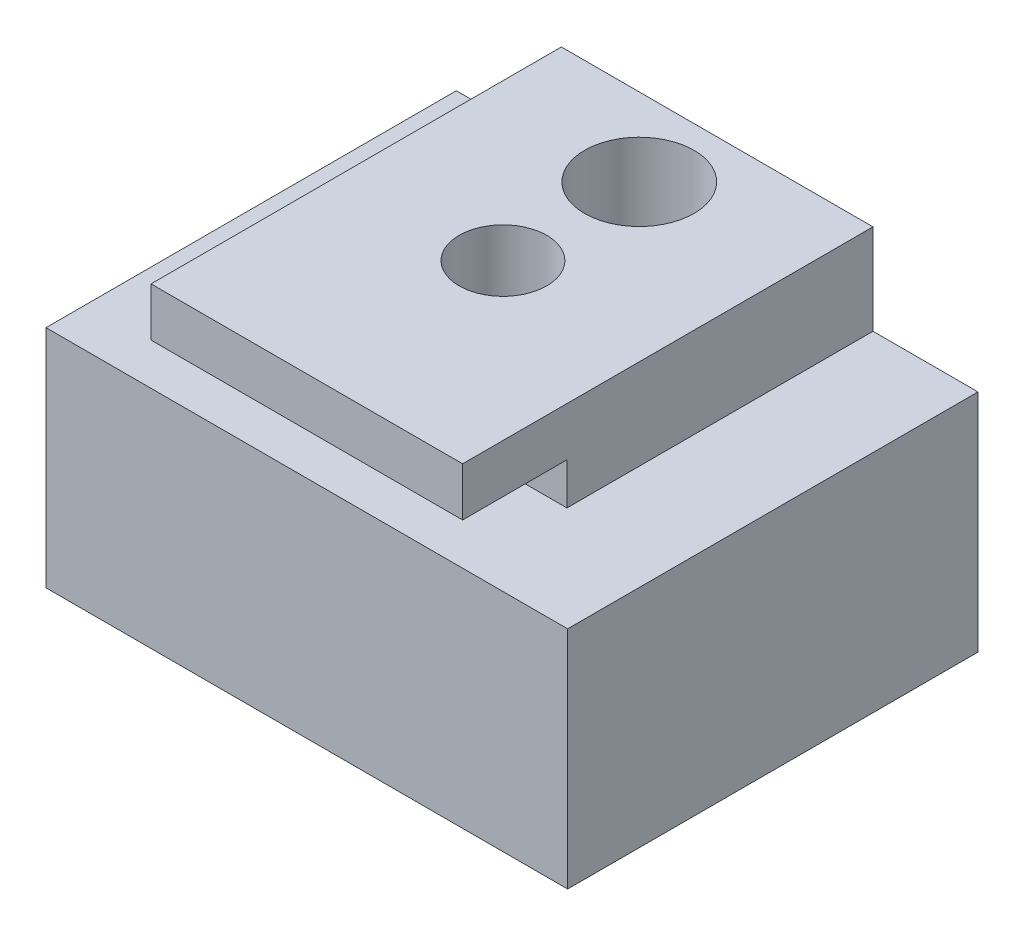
SolidWorks part; units mm, degrees
ref_plane "Front/Back" through (0, 0, 0) normal (0, 0, 1) x (1, 0, 0)
ref_plane "Top/Bottom" through (0, 0, 0) normal (0, 1, 0) x (1, 0, 0)
ref_plane "Right/Left" through (0, 0, 0) normal (1, 0, 0) x (0, 0, -1)
sketch "Sketch1" plane through (0, 0, 0) normal (0, 1, 0) x (1, 0, 0)
  line L0 (0, 0) -> (4.7625, 0) construction
  line L1 (-4.7625, 3.7465) -> (4.7625, 3.7465)
  line L2 (-4.7625, 3.7465) -> (-4.7625, -3.7465)
  line L3 (-4.7625, -3.7465) -> (4.7625, -3.7465)
  line L4 (4.7625, 3.7465) -> (4.7625, -3.7465)
  line L5 (0, 0) -> (0, 3.7465) construction
  dimension "D1" = 9.525
  dimension "D2" = 7.493
extrude "Extrude1" add sketch "Sketch1" along normal mid plane 4.1148
sketch "Sketch3" plane through (0, 2.0574, 0) normal (0, 1, 0) x (-1, 0, 0)
  line L0 (-4.7625, -3.7465) -> (4.7625, -3.7465) construction
  line L1 (-2.8448, -3.7465) -> (2.8448, -3.7465)
  line L2 (-2.8448, -3.7465) -> (-2.8448, 3.7465)
  line L3 (-2.8448, 3.7465) -> (2.8448, 3.7465)
  line L4 (2.8448, -3.7465) -> (2.8448, 3.7465)
  line L5 (4.7625, 3.7465) -> (-4.7625, 3.7465) construction
  line L6 (0, 0) -> (5.0127, 0) construction
  line L7 (0, 0) -> (0, 4.6204) construction
  dimension "D1" = 5.6896
extrude "Extrude2" add sketch "Sketch3" along normal blind 1.651
hole_wizard "M2x0.4 Tapped Hole1" positions "Sketch5" profile "Sketch4" tap size "M2x0.4" standard "ANSI Metric"
sketch "Sketch5" plane through (0, 3.7084, 0) normal (0, 1, 0) x (-1, 0, 0)
  line L0 (0, 0) -> (0, 4.8122) construction
  line L1 (-2.8448, -3.7465) -> (2.8448, -3.7465) construction
  point P0 (0, 0.1651)
  dimension "D1" = 3.9116
sketch "Sketch4" plane through (0, 3.7084, 0.1651) normal (1, 0, 0) x (0, 0, 1)
  line L0 (0, 0) -> (0, 5.7658)
  line L1 (0, 5.7658) -> (0.8, 5.7658)
  line L2 (0.8, 5.7658) -> (0.8, 0)
  line L5 (0.8, 0) -> (0, 0)
  line L11 (0, -6.35) -> (0, 107.95) construction
  dimension "Thru Tap Drill Dia." = 1.6
  dimension "Thru Tap Drill Depth" = 5.7658
sketch "Sketch6" plane through (0, 3.7084, 0) normal (0, 1, 0) x (-1, 0, 0)
  line L0 (0, 0) -> (0, -3.9747) construction
  line L1 (-2.8448, -3.7465) -> (2.8448, -3.7465) construction
  circle A0 centre (0, -2.3241) radius 0.9995
  dimension "D1" = 1.999
  dimension "D2" = 1.4224
extrude "2mm Dowel Hole - Press Fit" cut sketch "Sketch6" against normal blind 1.5875
sketch "Sketch7" plane through (0, 0, 0) normal (1, 0, 0) x (0, 0, -1)
  line L0 (-3.7465, 3.7084) -> (-3.7465, 2.0574) construction
  line L1 (-3.7465, 2.8194) -> (-1.8415, 2.8194)
  line L2 (-3.7465, 2.8194) -> (-3.7465, 2.0574)
  line L3 (-3.7465, 2.0574) -> (-1.8415, 2.0574)
  line L4 (-1.8415, 2.8194) -> (-1.8415, 2.0574)
  line L5 (-3.7465, 2.0574) -> (3.7465, 2.0574) construction
  dimension "D1" = 1.905
  dimension "D2" = 0.762
extrude "Cut-Extrude1" cut sketch "Sketch7" against normal through all and the other way through all
